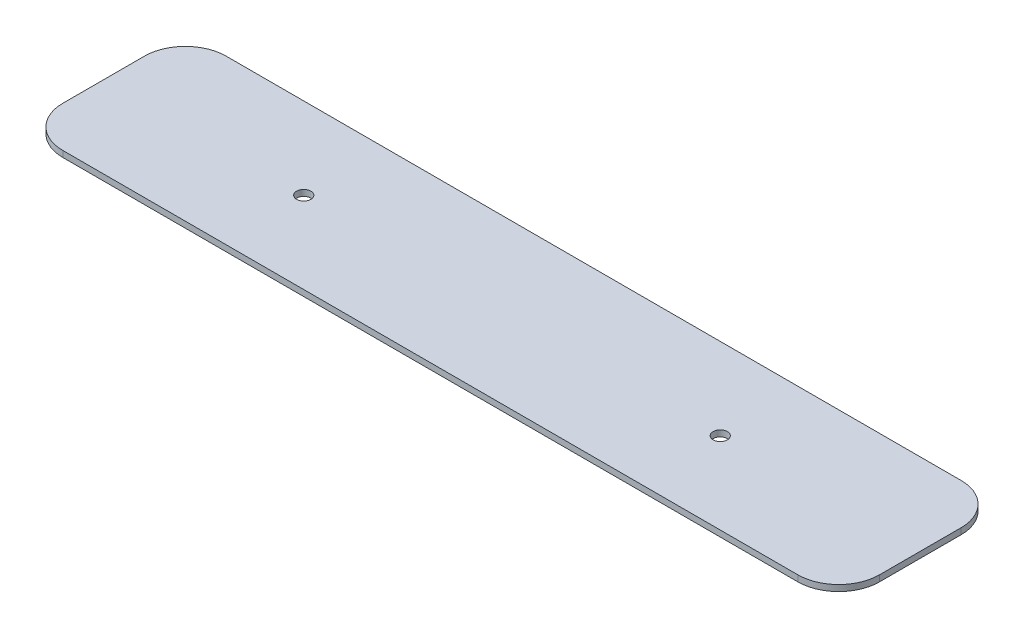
SolidWorks part; units mm, degrees
ref_plane "Front" through (0, 0, 0) normal (0, 0, 1) x (1, 0, 0)
ref_plane "Top" through (0, 0, 0) normal (0, 1, 0) x (1, 0, 0)
ref_plane "Right" through (0, 0, 0) normal (1, 0, 0) x (0, 0, -1)
sketch "Sketch1" plane through (0, 0, 0) normal (0, 1, 0) x (1, 0, 0)
  line L1 (10, 0) -> (190, 0)
  line L2 (0, 10) -> (0, 30)
  line L3 (10, 40) -> (190, 40)
  line L4 (200, 10) -> (200, 30)
  circle A0 centre (49, 20) radius 1.75
  circle A1 centre (151, 20) radius 1.75
  arc A2 (0, 30) -> (10, 40) centre (10, 30) cw
  arc A3 (10, 0) -> (0, 10) centre (10, 10) cw
  arc A4 (200, 10) -> (190, 0) centre (190, 10) cw
  arc A5 (190, 40) -> (200, 30) centre (190, 30) cw
  point P9 (0, 0)
extrude "Extrude1" add sketch "Sketch1" along normal blind 1.5
